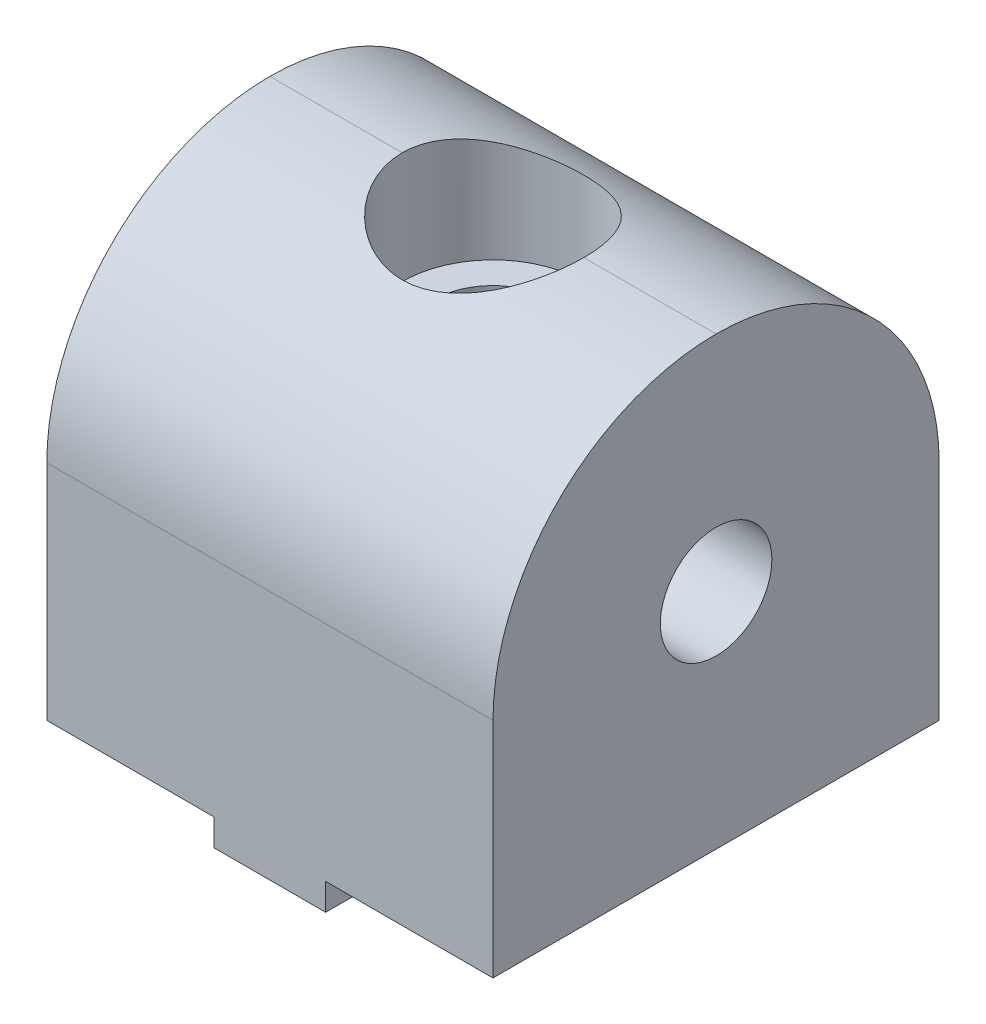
SolidWorks part; units mm, degrees
ref_plane "Front Plane" through (0, 0, 0) normal (0, 0, 1) x (1, 0, 0)
ref_plane "Top Plane" through (0, 0, 0) normal (0, 1, 0) x (1, 0, 0)
ref_plane "Right Plane" through (0, 0, 0) normal (1, 0, 0) x (0, 0, -1)
sketch "Sketch1" plane through (0, 0, 0) normal (0, 1, 0) x (1, 0, 0)
  line L1 (-12.7, -12.7) -> (12.7, -12.7)
  line L2 (-12.7, -12.7) -> (-12.7, 12.7)
  line L3 (-12.7, 12.7) -> (12.7, 12.7)
  line L4 (12.7, -12.7) -> (12.7, 12.7)
  line L5 (-12.7, -12.7) -> (12.7, 12.7) construction
  line L6 (-12.7, 12.7) -> (12.7, -12.7) construction
  point P0 (0, 0)
  dimension "D1" = 25.4
  dimension "D2" = 25.4
extrude "Boss-Extrude1" add sketch "Sketch1" along normal blind 25.4
fillet "Fillet1" radius 12.7 2 edges at (0, 25.4, -12.7) (0, 25.4, 12.7)
ref_plane "Plane1" through (0, 25.4, 0) normal (0, 1, 0) x (1, 0, 0)
sketch "Sketch2" plane through (0, 25.4, 0) normal (0, 1, 0) x (1, 0, 0)
  circle A0 centre (0, 0) radius 3.3782
  dimension "D1" = 6.7564
extrude "Cut-Extrude1" cut sketch "Sketch2" against normal through all
sketch "Sketch3" plane through (12.7, 0, 0) normal (1, 0, 0) x (0, 0, -1)
  line L0 (0, 12.7) -> (-12.7, 12.7) construction
  line L1 (0, 12.7) -> (0, 0) construction
  circle A0 centre (0, 12.7) radius 3.175
  dimension "D1" = 6.35
extrude "Cut-Extrude2" cut sketch "Sketch3" against normal through all
sketch "Sketch4" plane through (0, 25.4, 0) normal (0, 1, 0) x (1, 0, 0)
  circle A0 centre (0, 0) radius 5.1689
  dimension "D1" = 10.3378
extrude "Cut-Extrude3" cut sketch "Sketch4" against normal blind 6.35
sketch "Sketch5" plane through (0, 0, 0) normal (0, -1, 0) x (1, 0, 0)
  line L0 (3.175, -12.7) -> (3.175, -6.35)
  line L1 (-12.7, 0) -> (12.7, 0) construction
  line L2 (-12.7, -12.7) -> (-12.7, 12.7) construction
  line L3 (12.7, 12.7) -> (12.7, -12.7) construction
  line L4 (-12.7, 12.7) -> (12.7, 12.7) construction
  line L5 (-3.175, 12.7) -> (3.175, 12.7)
  line L6 (-3.175, 12.7) -> (-3.175, 6.35)
  line L7 (-3.175, -6.35) -> (3.175, -6.35)
  line L8 (-3.175, -12.7) -> (-3.175, -6.35)
  line L9 (-3.175, 6.35) -> (3.175, 6.35)
  line L10 (3.175, 12.7) -> (3.175, 6.35)
  line L11 (0, 6.35) -> (0, 0) construction
  line L12 (-3.175, -12.7) -> (3.175, -12.7)
  dimension "D1" = 6.35
  dimension "D2" = 6.35
extrude "Boss-Extrude2" add sketch "Sketch5" along normal blind 1.524
